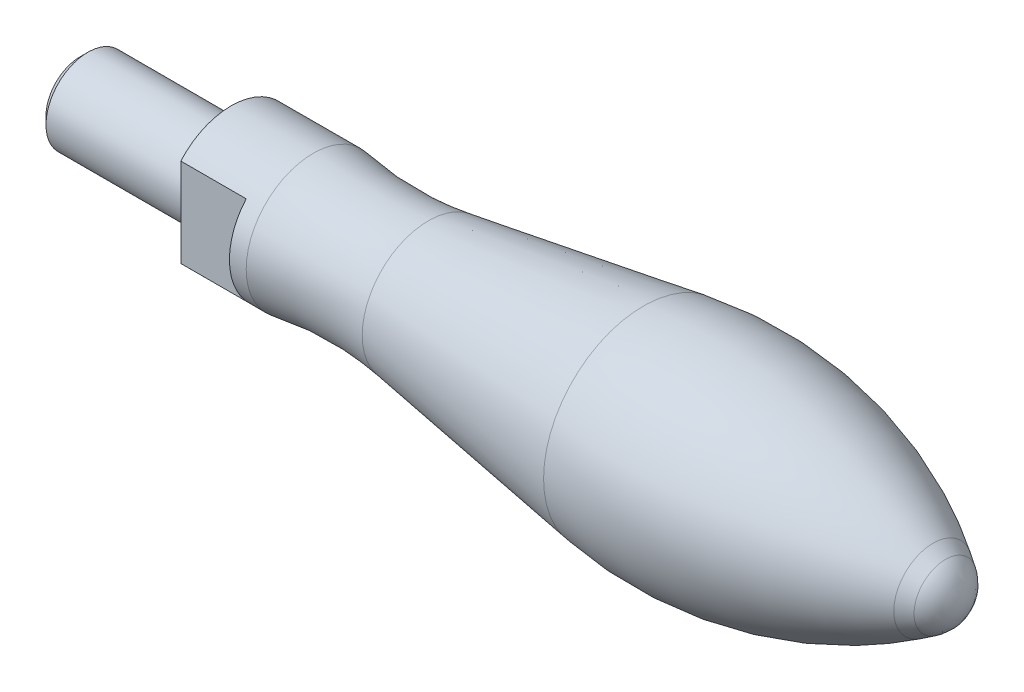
SolidWorks part; units mm, degrees
ref_plane "Front X-Y" through (0, 0, 0) normal (0, 0, 1) x (1, 0, 0)
ref_plane "Top X-Z" through (0, 0, 0) normal (0, 1, 0) x (1, 0, 0)
ref_plane "Right Y-Z" through (0, 0, 0) normal (1, 0, 0) x (0, 0, -1)
ref_plane "Plane1" through (0, 0, 0) normal (0, 0, 1) x (1, 0, 0)
sketch "Sketch1" plane through (0, 0, 0) normal (0, 0, 1) x (1, 0, 0)
  line L0 (0, 0) -> (0, 8)
  line L1 (0, 8) -> (9.8, 8)
  line L2 (23.5346, 7.8905) -> (49.1759, 11.8998)
  line L3 (83.739, 4.6861) -> (85.2155, 3.7468)
  line L4 (87.2997, 0) -> (0, 0)
  line L5 (87.3, 0) -> (0, 0) construction
  arc A0 (9.8, 8) -> (23.5346, 7.8905) centre (17, 49.6827) ccw
  arc A1 (49.1759, 11.8998) -> (83.739, 4.6861) centre (56.9, -37.5) cw
  arc A2 (85.2155, 3.7468) -> (87.2997, 0) centre (82.8, -0.05) cw
revolve "Revolve1" add sketch "Sketch1" angle 360 about L5
ref_plane "Plane2" through (0, 0, 0) normal (0, 0, 1) x (1, 0, 0)
sketch "Sketch2" plane through (0, 0, 0) normal (0, 0, 1) x (1, 0, 0)
  line L0 (-18, 0) -> (-18, 4.08)
  line L1 (-18, 4.08) -> (-17.08, 5)
  line L2 (-17.08, 5) -> (0, 5)
  line L3 (0, 5) -> (0, 0)
  line L4 (0, 0) -> (-18, 0)
  line L5 (0, 0) -> (-18, 0) construction
revolve "Revolve2" add sketch "Sketch2" angle 360 about L5
ref_plane "Plane3" through (0, 0, 0) normal (1, 0, 0) x (0, 0, -1)
sketch "Sketch3" plane through (0, 0, 0) normal (1, 0, 0) x (0, 0, -1)
  line L0 (-25, -25) -> (25, -25)
  line L1 (25, -25) -> (25, 25)
  line L2 (25, 25) -> (-25, 25)
  line L3 (-25, 25) -> (-25, -25)
  line L4 (6, -5.2915) -> (6, 5.2915)
  line L5 (-6, 5.2915) -> (-6, -5.2915)
  arc A0 (-6, -5.2915) -> (6, -5.2915) centre (0, 0) ccw
  arc A1 (6, 5.2915) -> (-6, 5.2915) centre (0, 0) ccw
extrude "Cut-Extrude1" cut sketch "Sketch3" along normal blind 7.8
